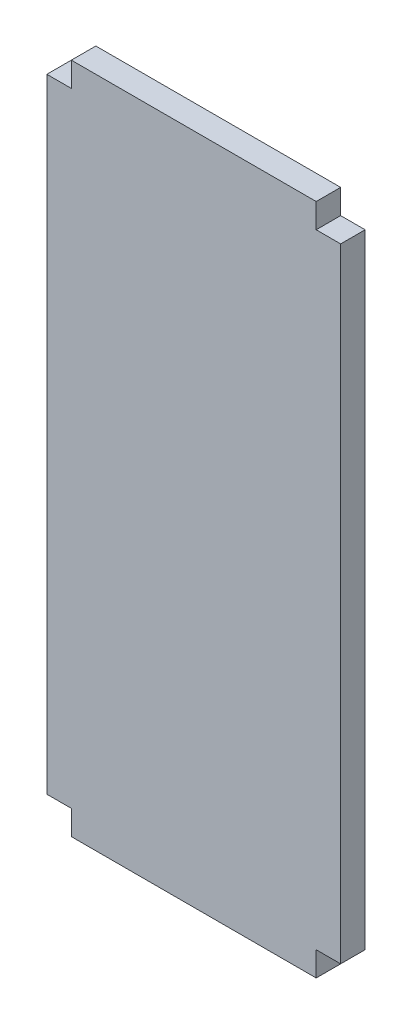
SolidWorks part; units mm, degrees
ref_plane "Alzado" through (0, 0, 0) normal (0, 0, 1) x (1, 0, 0)
ref_plane "Planta" through (0, 0, 0) normal (0, 1, 0) x (1, 0, 0)
ref_plane "Vista lateral" through (0, 0, 0) normal (1, 0, 0) x (0, 0, -1)
sketch "Croquis1" plane through (0, 0, 0) normal (0, 0, 1) x (1, 0, 0)
  line L1 (-18, -38.2) -> (18, -38.2)
  line L2 (-18, -38.2) -> (-18, 38.2)
  line L3 (-18, 38.2) -> (18, 38.2)
  line L4 (18, -38.2) -> (18, 38.2)
  line L5 (-18, -38.2) -> (18, 38.2) construction
  line L6 (-18, 38.2) -> (18, -38.2) construction
  point P0 (0, 0)
  dimension "D1" = 76.4
  dimension "D2" = 36
extrude "Saliente-Extruir1" add sketch "Croquis1" along normal blind 3
sketch "Croquis2" plane through (0, 38.2, 0) normal (0, 1, 0) x (1, 0, 0)
  line L0 (18, 0) -> (-18, 0) construction
  line L1 (-15, 0) -> (15, 0)
  line L2 (-15, 0) -> (-15, -3)
  line L3 (-15, -3) -> (15, -3)
  line L4 (15, 0) -> (15, -3)
  line L5 (18, -3) -> (-18, -3) construction
  point P8 (0, -3)
  dimension "D1" = 30
extrude "Saliente-Extruir2" add sketch "Croquis2" along normal blind 3
sketch "Croquis3" plane through (0, -38.2, 0) normal (0, -1, 0) x (1, 0, 0)
  line L0 (-18, 3) -> (18, 3) construction
  line L1 (-15, 3) -> (15, 3)
  line L2 (-15, 3) -> (-15, 0)
  line L3 (-15, 0) -> (15, 0)
  line L4 (15, 3) -> (15, 0)
  line L5 (-18, 0) -> (18, 0) construction
  point P8 (0, 0)
  dimension "D1" = 30
extrude "Saliente-Extruir3" add sketch "Croquis3" along normal blind 3
